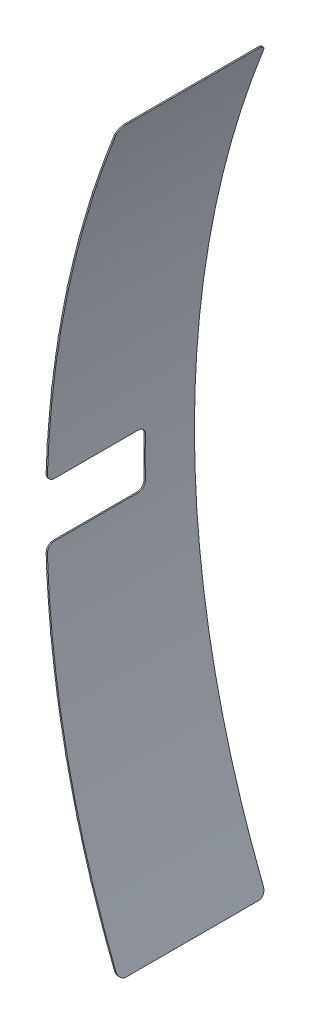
SolidWorks part; units mm, degrees
ref_plane "前视基准面" through (0, 0, 0) normal (0, 0, 1) x (1, 0, 0)
ref_plane "上视基准面" through (0, 0, 0) normal (0, 1, 0) x (1, 0, 0)
ref_plane "右视基准面" through (0, 0, 0) normal (1, 0, 0) x (0, 0, -1)
sketch "草图1" plane through (0, 0, 0) normal (0, 0, 1) x (1, 0, 0)
  line L0 (-37.1349, 15) -> (-37.081, 15)
  line L1 (-37.1349, -15) -> (-37.081, -15)
  line L2 (-1000, 0) -> (49000, 0) construction
  arc A0 (-37.1349, 15) -> (-37.1349, -15) centre (0, 0) ccw
  arc A1 (-37.081, 15) -> (-37.081, -15) centre (0, 0) ccw
  dimension "D1" = 80.1
  dimension "D2" = 80
  dimension "D3" = 30
extrude "凸台-拉伸1" add sketch "草图1" along normal blind 6
ref_plane "基准面1" through (-50, 0, 0) normal (1, 0, 0) x (0, 0, -1)
sketch "草图4" plane through (0, 0, 0) normal (1, 0, 0) x (0, 0, -1)
  line L0 (-6, -1.1) -> (-2, -1.1)
  line L1 (-6, 15) -> (-6, -15) construction
  line L2 (-2, -1.1) -> (-2, 1.1)
  line L3 (-2, 1.1) -> (-6, 1.1)
  line L4 (-6, 1.1) -> (-6, -1.1)
  line L5 (-1000, 0) -> (49000, 0) construction
  dimension "D1" = 4
  dimension "D2" = 2.2
extrude "切除-拉伸1" cut sketch "草图4" against normal through all
fillet "圆角1" radius 0.3 8 edges at (-37.108, -15, 6) (-37.108, -15, 0) (-37.108, 15, 6) (-37.108, 15, 0) (-40.0099, -1.1, 2) (-40.0099, 1.1, 2) (-40.0099, 1.1, 6) (-40.0099, -1.1, 6)
sketch "草图5" plane through (-50, 0, 0) normal (1, 0, 0) x (0, 0, -1)
  line L0 (0, -2.8572) -> (0, 3.1428)
  line L1 (0, 3.1428) -> (-2, 0.1428)
  line L2 (-2, 0.1428) -> (0, -2.8572)
  line L3 (-1002, 0.1428) -> (48998, 0.1428) construction
  line L4 (0, -14.7) -> (0, 14.7) construction
  line L5 (-2, 0.8) -> (-2, -0.8) construction
  line L6 (-6, -1.4) -> (-6, -14.7) construction
  line L7 (-6, -2.3) -> (-2, -2.3)
  line L8 (-6, -2.3) -> (-6, -2.1)
  line L9 (-6, -2.1) -> (-2, -2.1)
  line L10 (-2, -2.3) -> (-2, -2.1)
  line L11 (-6, -4.3) -> (-2, -4.3)
  line L12 (-6, -4.3) -> (-6, -4.1)
  line L13 (-6, -4.1) -> (-2, -4.1)
  line L14 (-2, -4.3) -> (-2, -4.1)
  line L15 (-6, -6.3) -> (-2, -6.3)
  line L16 (-6, -6.3) -> (-6, -6.1)
  line L17 (-6, -6.1) -> (-2, -6.1)
  line L18 (-2, -6.3) -> (-2, -6.1)
  line L19 (-6, -8.3) -> (-2, -8.3)
  line L20 (-6, -8.3) -> (-6, -8.1)
  line L21 (-6, -8.1) -> (-2, -8.1)
  line L22 (-2, -8.3) -> (-2, -8.1)
  line L23 (-6, -10.3) -> (-2, -10.3)
  line L24 (-6, -10.3) -> (-6, -10.1)
  line L25 (-6, -10.1) -> (-2, -10.1)
  line L26 (-2, -10.3) -> (-2, -10.1)
  line L27 (-6, -12.3) -> (-2, -12.3)
  line L28 (-6, -12.3) -> (-6, -12.1)
  line L29 (-6, -12.1) -> (-2, -12.1)
  line L30 (-2, -12.3) -> (-2, -12.1)
  line L31 (-5.7, -1.1) -> (-2.3, -1.1) construction
  line L32 (-2, 12.5855) -> (-2, 12.3855)
  line L33 (-6, 12.3855) -> (-2, 12.3855)
  line L34 (-6, 12.5855) -> (-6, 12.3855)
  line L35 (-6, 12.5855) -> (-2, 12.5855)
  line L36 (-2, 10.5855) -> (-2, 10.3855)
  line L37 (-6, 10.3855) -> (-2, 10.3855)
  line L38 (-6, 10.5855) -> (-6, 10.3855)
  line L39 (-6, 10.5855) -> (-2, 10.5855)
  line L40 (-2, 8.5855) -> (-2, 8.3855)
  line L41 (-6, 8.3855) -> (-2, 8.3855)
  line L42 (-6, 8.5855) -> (-6, 8.3855)
  line L43 (-6, 8.5855) -> (-2, 8.5855)
  line L44 (-2, 6.5855) -> (-2, 6.3855)
  line L45 (-6, 6.3855) -> (-2, 6.3855)
  line L46 (-6, 6.5855) -> (-6, 6.3855)
  line L47 (-6, 6.5855) -> (-2, 6.5855)
  line L48 (-2, 4.5855) -> (-2, 4.3855)
  line L49 (-6, 4.3855) -> (-2, 4.3855)
  line L50 (-6, 4.5855) -> (-6, 4.3855)
  line L51 (-6, 4.5855) -> (-2, 4.5855)
  line L52 (-2, 2.5855) -> (-2, 2.3855)
  line L53 (-6, 2.3855) -> (-2, 2.3855)
  line L54 (-6, 2.5855) -> (-6, 2.3855)
  line L55 (-6, 2.5855) -> (-2, 2.5855)
  dimension "D1" = 6
  dimension "D2" = 0.2
  dimension "D3" = 4
  dimension "D5" = 1
  dimension "D4" = 6
wrap "包覆1" sketch "草图5" wrap type emboss source sketch "草图5" thickness 0.01 parameters "D1"=0.01
